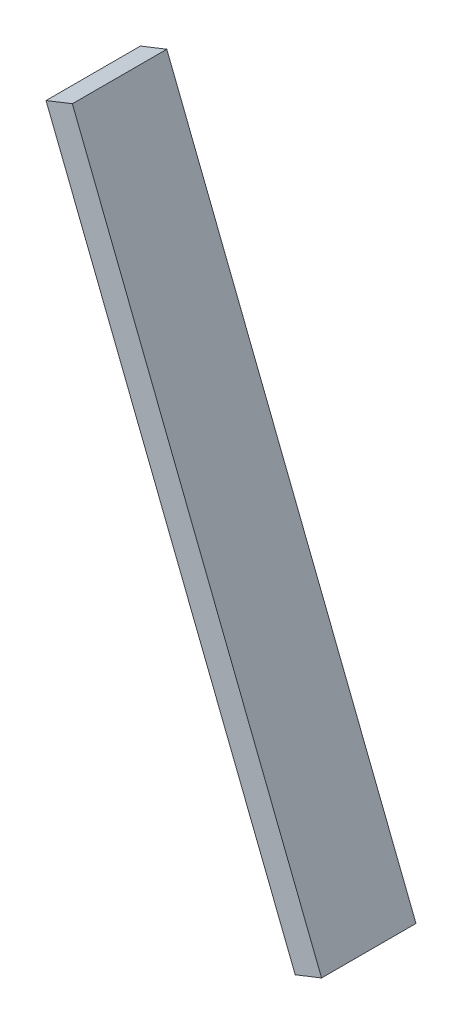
SolidWorks part; units mm, degrees
ref_plane "Plan de face" through (0, 0, 0) normal (0, 0, 1) x (1, 0, 0)
ref_plane "Plan de dessus" through (0, 0, 0) normal (0, 1, 0) x (1, 0, 0)
ref_plane "Plan de droite" through (0, 0, 0) normal (1, 0, 0) x (0, 0, -1)
sketch "Esquisse1" plane through (0, 0, 0) normal (0, 0, 1) x (1, 0, 0)
  line L0 (0, 0) -> (0, -67000) construction
  line L1 (0, -67000) -> (26392.0019, -67000) construction
  line L2 (26392.0019, -67000) -> (0, 0)
  line L3 (0, 0) -> (-2791.2527, -1099.5037)
  line L4 (-2791.2527, -1099.5037) -> (23600.7492, -68099.5037)
  line L5 (23600.7492, -68099.5037) -> (26392.0019, -67000)
  dimension "D1" = 67000
  dimension "D2" = 68.5
  dimension "D3" = 3000
extrude "Boss.-Extru.1" add sketch "Esquisse1" along normal mid plane 10000
